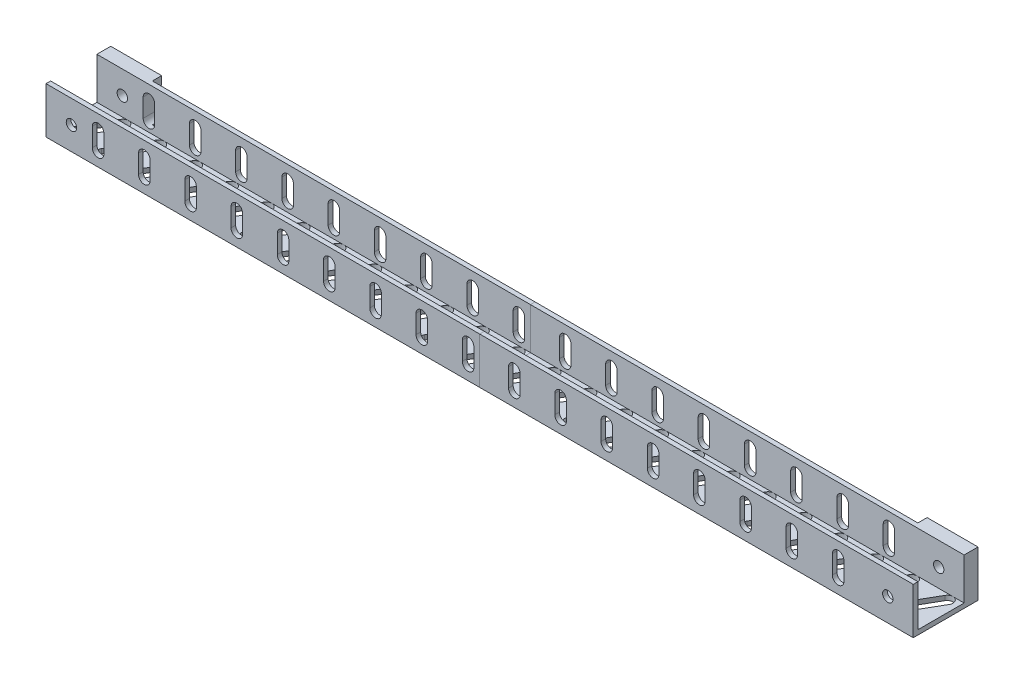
SolidWorks part; units mm, degrees
ref_plane "Front Plane" through (0, 0, 0) normal (0, 0, 1) x (1, 0, 0)
ref_plane "Top Plane" through (0, 0, 0) normal (0, 1, 0) x (1, 0, 0)
ref_plane "Right Plane" through (0, 0, 0) normal (1, 0, 0) x (0, 0, -1)
sketch "Sketch1" plane through (0, 0, 0) normal (1, 0, 0) x (0, 0, -1)
  line L0 (0, 0) -> (24, 0)
  line L1 (24, 0) -> (24, 20)
  line L2 (24, 20) -> (22, 20)
  line L3 (22, 20) -> (22, 2)
  line L4 (22, 2) -> (2, 2)
  line L5 (2, 2) -> (2, 20)
  line L6 (2, 20) -> (0, 20)
  line L7 (0, 20) -> (0, 0)
  dimension "D1" = 2
  dimension "D2" = 2
  dimension "D3" = 20
  dimension "D4" = 2
  dimension "D5" = 20
extrude "Boss-Extrude1" add sketch "Sketch1" along normal blind 375
sketch "Sketch2" plane through (0, 0, -24) normal (0, 0, -1) x (-1, 0, 0)
  line L0 (0, 0) -> (0, 20) construction
  line L1 (0, 0) -> (-22, 0)
  line L2 (0, 0) -> (0, 20)
  line L3 (0, 20) -> (-22, 20)
  line L4 (-22, 0) -> (-22, 20)
  line L5 (0, 10) -> (-375, 10) construction
  line L6 (-375, 0) -> (-375, 20) construction
  line L7 (-375, 20) -> (0, 20) construction
  line L8 (-187.5, 20) -> (-187.5, 0) construction
  line L9 (-375, 0) -> (0, 0) construction
  line L10 (-375, 20) -> (-353, 20)
  line L11 (-353, 0) -> (-353, 20)
  line L12 (-375, 0) -> (-353, 0)
  line L13 (-375, 0) -> (-375, 20)
  dimension "D1" = 22
extrude "Boss-Extrude2" add sketch "Sketch2" along normal blind 4
sketch "Sketch3" plane through (0, 0, -28) normal (0, 0, -1) x (-1, 0, 0)
  line L0 (0, 10) -> (-22, 10) construction
  line L1 (0, 0) -> (0, 20) construction
  line L2 (-22, 20) -> (-22, 0) construction
  line L3 (-187.5, 20) -> (-187.5, 0) construction
  line L4 (-353, 20) -> (-22, 20) construction
  line L5 (-353, 0) -> (-22, 0) construction
  circle A0 centre (-11, 10) radius 2.25
  circle A1 centre (-364, 10) radius 2.25
  dimension "D1" = 4.5
extrude "Cut-Extrude1" cut sketch "Sketch3" against normal through all
sketch "Sketch4" plane through (0, 2, 0) normal (0, 1, 0) x (1, 0, 0)
  line L0 (5, 4.5) -> (13.6603, 19.5) construction
  line L1 (2.8349, 5.75) -> (11.4952, 20.75)
  line L2 (7.1651, 3.25) -> (15.8253, 18.25)
  line L3 (375, 22) -> (0, 22) construction
  line L4 (375, 2) -> (0, 2) construction
  line L5 (375, 2) -> (0, 2) construction
  line L7 (0, 22) -> (0, 2) construction
  line L8 (22.6651, 3.25) -> (31.3253, 18.25)
  line L9 (18.3349, 5.75) -> (26.9952, 20.75)
  line L10 (20.5, 4.5) -> (29.1603, 19.5) construction
  line L11 (38.1651, 3.25) -> (46.8253, 18.25)
  line L12 (33.8349, 5.75) -> (42.4952, 20.75)
  line L13 (36, 4.5) -> (44.6603, 19.5) construction
  line L14 (53.6651, 3.25) -> (62.3253, 18.25)
  line L15 (49.3349, 5.75) -> (57.9952, 20.75)
  line L16 (51.5, 4.5) -> (60.1603, 19.5) construction
  line L17 (69.1651, 3.25) -> (77.8253, 18.25)
  line L18 (64.8349, 5.75) -> (73.4952, 20.75)
  line L19 (67, 4.5) -> (75.6603, 19.5) construction
  line L20 (84.6651, 3.25) -> (93.3253, 18.25)
  line L21 (80.3349, 5.75) -> (88.9952, 20.75)
  line L22 (82.5, 4.5) -> (91.1603, 19.5) construction
  line L23 (100.1651, 3.25) -> (108.8253, 18.25)
  line L24 (95.8349, 5.75) -> (104.4952, 20.75)
  line L25 (98, 4.5) -> (106.6603, 19.5) construction
  line L26 (115.6651, 3.25) -> (124.3253, 18.25)
  line L27 (111.3349, 5.75) -> (119.9952, 20.75)
  line L28 (113.5, 4.5) -> (122.1603, 19.5) construction
  line L29 (131.1651, 3.25) -> (139.8253, 18.25)
  line L30 (126.8349, 5.75) -> (135.4952, 20.75)
  line L31 (129, 4.5) -> (137.6603, 19.5) construction
  line L32 (146.6651, 3.25) -> (155.3253, 18.25)
  line L33 (142.3349, 5.75) -> (150.9952, 20.75)
  line L34 (144.5, 4.5) -> (153.1603, 19.5) construction
  line L35 (162.1651, 3.25) -> (170.8253, 18.25)
  line L36 (157.8349, 5.75) -> (166.4952, 20.75)
  line L37 (160, 4.5) -> (168.6603, 19.5) construction
  line L38 (177.6651, 3.25) -> (186.3253, 18.25)
  line L39 (173.3349, 5.75) -> (181.9952, 20.75)
  line L40 (175.5, 4.5) -> (184.1603, 19.5) construction
  line L41 (193.1651, 3.25) -> (201.8253, 18.25)
  line L42 (188.8349, 5.75) -> (197.4952, 20.75)
  line L43 (191, 4.5) -> (199.6603, 19.5) construction
  line L44 (208.6651, 3.25) -> (217.3253, 18.25)
  line L45 (204.3349, 5.75) -> (212.9952, 20.75)
  line L46 (206.5, 4.5) -> (215.1603, 19.5) construction
  line L47 (224.1651, 3.25) -> (232.8253, 18.25)
  line L48 (219.8349, 5.75) -> (228.4952, 20.75)
  line L49 (222, 4.5) -> (230.6603, 19.5) construction
  line L50 (239.6651, 3.25) -> (248.3253, 18.25)
  line L51 (235.3349, 5.75) -> (243.9952, 20.75)
  line L52 (237.5, 4.5) -> (246.1603, 19.5) construction
  line L53 (255.1651, 3.25) -> (263.8253, 18.25)
  line L54 (250.8349, 5.75) -> (259.4952, 20.75)
  line L55 (253, 4.5) -> (261.6603, 19.5) construction
  line L56 (270.6651, 3.25) -> (279.3253, 18.25)
  line L57 (266.3349, 5.75) -> (274.9952, 20.75)
  line L58 (268.5, 4.5) -> (277.1603, 19.5) construction
  line L59 (286.1651, 3.25) -> (294.8253, 18.25)
  line L60 (281.8349, 5.75) -> (290.4952, 20.75)
  line L61 (284, 4.5) -> (292.6603, 19.5) construction
  line L62 (301.6651, 3.25) -> (310.3253, 18.25)
  line L63 (297.3349, 5.75) -> (305.9952, 20.75)
  line L64 (299.5, 4.5) -> (308.1603, 19.5) construction
  line L65 (317.1651, 3.25) -> (325.8253, 18.25)
  line L66 (312.8349, 5.75) -> (321.4952, 20.75)
  line L67 (315, 4.5) -> (323.6603, 19.5) construction
  line L68 (332.6651, 3.25) -> (341.3253, 18.25)
  line L69 (328.3349, 5.75) -> (336.9952, 20.75)
  line L70 (330.5, 4.5) -> (339.1603, 19.5) construction
  line L71 (348.1651, 3.25) -> (356.8253, 18.25)
  line L72 (343.8349, 5.75) -> (352.4952, 20.75)
  line L73 (346, 4.5) -> (354.6603, 19.5) construction
  line L74 (363.6651, 3.25) -> (372.3253, 18.25)
  line L75 (359.3349, 5.75) -> (367.9952, 20.75)
  line L76 (361.5, 4.5) -> (370.1603, 19.5) construction
  line L79 (365, 4.5) -> (373.6603, 19.5) construction
  line L80 (7.1651, 3.25) -> (22.6651, 3.25) construction
  arc A0 (2.8349, 5.75) -> (7.1651, 3.25) centre (5, 4.5) ccw
  arc A1 (15.8253, 18.25) -> (11.4952, 20.75) centre (13.6603, 19.5) ccw
  arc A2 (18.3349, 5.75) -> (22.6651, 3.25) centre (20.5, 4.5) ccw
  arc A3 (31.3253, 18.25) -> (26.9952, 20.75) centre (29.1603, 19.5) ccw
  arc A4 (33.8349, 5.75) -> (38.1651, 3.25) centre (36, 4.5) ccw
  arc A5 (46.8253, 18.25) -> (42.4952, 20.75) centre (44.6603, 19.5) ccw
  arc A6 (49.3349, 5.75) -> (53.6651, 3.25) centre (51.5, 4.5) ccw
  arc A7 (62.3253, 18.25) -> (57.9952, 20.75) centre (60.1603, 19.5) ccw
  arc A8 (64.8349, 5.75) -> (69.1651, 3.25) centre (67, 4.5) ccw
  arc A9 (77.8253, 18.25) -> (73.4952, 20.75) centre (75.6603, 19.5) ccw
  arc A10 (80.3349, 5.75) -> (84.6651, 3.25) centre (82.5, 4.5) ccw
  arc A11 (93.3253, 18.25) -> (88.9952, 20.75) centre (91.1603, 19.5) ccw
  arc A12 (95.8349, 5.75) -> (100.1651, 3.25) centre (98, 4.5) ccw
  arc A13 (108.8253, 18.25) -> (104.4952, 20.75) centre (106.6603, 19.5) ccw
  arc A14 (111.3349, 5.75) -> (115.6651, 3.25) centre (113.5, 4.5) ccw
  arc A15 (124.3253, 18.25) -> (119.9952, 20.75) centre (122.1603, 19.5) ccw
  arc A16 (126.8349, 5.75) -> (131.1651, 3.25) centre (129, 4.5) ccw
  arc A17 (139.8253, 18.25) -> (135.4952, 20.75) centre (137.6603, 19.5) ccw
  arc A18 (142.3349, 5.75) -> (146.6651, 3.25) centre (144.5, 4.5) ccw
  arc A19 (155.3253, 18.25) -> (150.9952, 20.75) centre (153.1603, 19.5) ccw
  arc A20 (157.8349, 5.75) -> (162.1651, 3.25) centre (160, 4.5) ccw
  arc A21 (170.8253, 18.25) -> (166.4952, 20.75) centre (168.6603, 19.5) ccw
  arc A22 (173.3349, 5.75) -> (177.6651, 3.25) centre (175.5, 4.5) ccw
  arc A23 (186.3253, 18.25) -> (181.9952, 20.75) centre (184.1603, 19.5) ccw
  arc A24 (188.8349, 5.75) -> (193.1651, 3.25) centre (191, 4.5) ccw
  arc A25 (201.8253, 18.25) -> (197.4952, 20.75) centre (199.6603, 19.5) ccw
  arc A26 (204.3349, 5.75) -> (208.6651, 3.25) centre (206.5, 4.5) ccw
  arc A27 (217.3253, 18.25) -> (212.9952, 20.75) centre (215.1603, 19.5) ccw
  arc A28 (219.8349, 5.75) -> (224.1651, 3.25) centre (222, 4.5) ccw
  arc A29 (232.8253, 18.25) -> (228.4952, 20.75) centre (230.6603, 19.5) ccw
  arc A30 (235.3349, 5.75) -> (239.6651, 3.25) centre (237.5, 4.5) ccw
  arc A31 (248.3253, 18.25) -> (243.9952, 20.75) centre (246.1603, 19.5) ccw
  arc A32 (250.8349, 5.75) -> (255.1651, 3.25) centre (253, 4.5) ccw
  arc A33 (263.8253, 18.25) -> (259.4952, 20.75) centre (261.6603, 19.5) ccw
  arc A34 (266.3349, 5.75) -> (270.6651, 3.25) centre (268.5, 4.5) ccw
  arc A35 (279.3253, 18.25) -> (274.9952, 20.75) centre (277.1603, 19.5) ccw
  arc A36 (281.8349, 5.75) -> (286.1651, 3.25) centre (284, 4.5) ccw
  arc A37 (294.8253, 18.25) -> (290.4952, 20.75) centre (292.6603, 19.5) ccw
  arc A38 (297.3349, 5.75) -> (301.6651, 3.25) centre (299.5, 4.5) ccw
  arc A39 (310.3253, 18.25) -> (305.9952, 20.75) centre (308.1603, 19.5) ccw
  arc A40 (312.8349, 5.75) -> (317.1651, 3.25) centre (315, 4.5) ccw
  arc A41 (325.8253, 18.25) -> (321.4952, 20.75) centre (323.6603, 19.5) ccw
  arc A42 (328.3349, 5.75) -> (332.6651, 3.25) centre (330.5, 4.5) ccw
  arc A43 (341.3253, 18.25) -> (336.9952, 20.75) centre (339.1603, 19.5) ccw
  arc A44 (343.8349, 5.75) -> (348.1651, 3.25) centre (346, 4.5) ccw
  arc A45 (356.8253, 18.25) -> (352.4952, 20.75) centre (354.6603, 19.5) ccw
  arc A46 (359.3349, 5.75) -> (363.6651, 3.25) centre (361.5, 4.5) ccw
  arc A47 (372.3253, 18.25) -> (367.9952, 20.75) centre (370.1603, 19.5) ccw
  point P2 (9.3301, 12)
  point P14 (24.8301, 12)
  point P26 (40.3301, 12)
  point P33 (55.8301, 12)
  point P40 (71.3301, 12)
  point P47 (86.8301, 12)
  point P54 (102.3301, 12)
  point P61 (117.8301, 12)
  point P68 (133.3301, 12)
  point P75 (148.8301, 12)
  point P82 (164.3301, 12)
  point P89 (179.8301, 12)
  point P96 (195.3301, 12)
  point P103 (210.8301, 12)
  point P110 (226.3301, 12)
  point P117 (241.8301, 12)
  point P124 (257.3301, 12)
  point P131 (272.8301, 12)
  point P138 (288.3301, 12)
  point P145 (303.8301, 12)
  point P152 (319.3301, 12)
  point P159 (334.8301, 12)
  point P166 (350.3301, 12)
  point P173 (365.8301, 12)
  point P180 (369.3301, 12)
  dimension "D1" = 5
  dimension "D2" = 60
  dimension "D3" = 5
  dimension "D5" = 15.5
  dimension "D4" = 24
extrude "Cut-Extrude2" cut sketch "Sketch4" against normal through all
sketch "Sketch5" plane through (0, 0, 0) normal (0, 0, 1) x (1, 0, 0)
  line L0 (22.5, 14) -> (22.5, 6) construction
  line L1 (25, 14) -> (25, 6)
  line L2 (20, 14) -> (20, 6)
  line L3 (0, 10) -> (375, 10) construction
  line L4 (0, 20) -> (0, 0) construction
  line L5 (375, 20) -> (375, 0) construction
  line L6 (40, 14) -> (40, 6)
  line L7 (45, 14) -> (45, 6)
  line L8 (42.5, 14) -> (42.5, 6) construction
  line L9 (60, 14) -> (60, 6)
  line L10 (65, 14) -> (65, 6)
  line L11 (62.5, 14) -> (62.5, 6) construction
  line L12 (80, 14) -> (80, 6)
  line L13 (85, 14) -> (85, 6)
  line L14 (82.5, 14) -> (82.5, 6) construction
  line L15 (100, 14) -> (100, 6)
  line L16 (105, 14) -> (105, 6)
  line L17 (102.5, 14) -> (102.5, 6) construction
  line L18 (120, 14) -> (120, 6)
  line L19 (125, 14) -> (125, 6)
  line L20 (122.5, 14) -> (122.5, 6) construction
  line L21 (140, 14) -> (140, 6)
  line L22 (145, 14) -> (145, 6)
  line L23 (142.5, 14) -> (142.5, 6) construction
  line L24 (160, 14) -> (160, 6)
  line L25 (165, 14) -> (165, 6)
  line L26 (162.5, 14) -> (162.5, 6) construction
  line L27 (180, 14) -> (180, 6)
  line L28 (185, 14) -> (185, 6)
  line L29 (182.5, 14) -> (182.5, 6) construction
  line L30 (200, 14) -> (200, 6)
  line L31 (205, 14) -> (205, 6)
  line L32 (202.5, 14) -> (202.5, 6) construction
  line L33 (220, 14) -> (220, 6)
  line L34 (225, 14) -> (225, 6)
  line L35 (222.5, 14) -> (222.5, 6) construction
  line L36 (240, 14) -> (240, 6)
  line L37 (245, 14) -> (245, 6)
  line L38 (242.5, 14) -> (242.5, 6) construction
  line L39 (260, 14) -> (260, 6)
  line L40 (265, 14) -> (265, 6)
  line L41 (262.5, 14) -> (262.5, 6) construction
  line L42 (280, 14) -> (280, 6)
  line L43 (285, 14) -> (285, 6)
  line L44 (282.5, 14) -> (282.5, 6) construction
  line L45 (300, 14) -> (300, 6)
  line L46 (305, 14) -> (305, 6)
  line L47 (302.5, 14) -> (302.5, 6) construction
  line L48 (320, 14) -> (320, 6)
  line L49 (325, 14) -> (325, 6)
  line L50 (322.5, 14) -> (322.5, 6) construction
  line L51 (340, 14) -> (340, 6)
  line L52 (345, 14) -> (345, 6)
  line L53 (342.5, 14) -> (342.5, 6) construction
  line L54 (20, 14) -> (40, 14) construction
  arc A0 (25, 14) -> (20, 14) centre (22.5, 14) ccw
  arc A1 (20, 6) -> (25, 6) centre (22.5, 6) ccw
  arc A2 (45, 14) -> (40, 14) centre (42.5, 14) ccw
  arc A3 (40, 6) -> (45, 6) centre (42.5, 6) ccw
  arc A4 (65, 14) -> (60, 14) centre (62.5, 14) ccw
  arc A5 (60, 6) -> (65, 6) centre (62.5, 6) ccw
  arc A6 (85, 14) -> (80, 14) centre (82.5, 14) ccw
  arc A7 (80, 6) -> (85, 6) centre (82.5, 6) ccw
  arc A8 (105, 14) -> (100, 14) centre (102.5, 14) ccw
  arc A9 (100, 6) -> (105, 6) centre (102.5, 6) ccw
  arc A10 (125, 14) -> (120, 14) centre (122.5, 14) ccw
  arc A11 (120, 6) -> (125, 6) centre (122.5, 6) ccw
  arc A12 (145, 14) -> (140, 14) centre (142.5, 14) ccw
  arc A13 (140, 6) -> (145, 6) centre (142.5, 6) ccw
  arc A14 (165, 14) -> (160, 14) centre (162.5, 14) ccw
  arc A15 (160, 6) -> (165, 6) centre (162.5, 6) ccw
  arc A16 (185, 14) -> (180, 14) centre (182.5, 14) ccw
  arc A17 (180, 6) -> (185, 6) centre (182.5, 6) ccw
  arc A18 (205, 14) -> (200, 14) centre (202.5, 14) ccw
  arc A19 (200, 6) -> (205, 6) centre (202.5, 6) ccw
  arc A20 (225, 14) -> (220, 14) centre (222.5, 14) ccw
  arc A21 (220, 6) -> (225, 6) centre (222.5, 6) ccw
  arc A22 (245, 14) -> (240, 14) centre (242.5, 14) ccw
  arc A23 (240, 6) -> (245, 6) centre (242.5, 6) ccw
  arc A24 (265, 14) -> (260, 14) centre (262.5, 14) ccw
  arc A25 (260, 6) -> (265, 6) centre (262.5, 6) ccw
  arc A26 (285, 14) -> (280, 14) centre (282.5, 14) ccw
  arc A27 (280, 6) -> (285, 6) centre (282.5, 6) ccw
  arc A28 (305, 14) -> (300, 14) centre (302.5, 14) ccw
  arc A29 (300, 6) -> (305, 6) centre (302.5, 6) ccw
  arc A30 (325, 14) -> (320, 14) centre (322.5, 14) ccw
  arc A31 (320, 6) -> (325, 6) centre (322.5, 6) ccw
  arc A32 (345, 14) -> (340, 14) centre (342.5, 14) ccw
  arc A33 (340, 6) -> (345, 6) centre (342.5, 6) ccw
  point P2 (22.5, 10)
  point P17 (42.5, 10)
  point P24 (62.5, 10)
  point P31 (82.5, 10)
  point P38 (102.5, 10)
  point P45 (122.5, 10)
  point P52 (142.5, 10)
  point P59 (162.5, 10)
  point P66 (182.5, 10)
  point P73 (202.5, 10)
  point P80 (222.5, 10)
  point P87 (242.5, 10)
  point P94 (262.5, 10)
  point P101 (282.5, 10)
  point P108 (302.5, 10)
  point P115 (322.5, 10)
  point P122 (342.5, 10)
  dimension "D2" = 8
  dimension "D1" = 5
  dimension "D3" = 20
  dimension "D5" = 20
  dimension "D4" = 17
extrude "Cut-Extrude3" cut sketch "Sketch5" against normal through all
ref_plane "Plane1" through (187.5, 0, 0) normal (-1, 0, 0) x (0, 0, 1)
sketch "Sketch6" plane through (187.5, 0, 0) normal (-1, 0, 0) x (0, 0, 1)
  line L1 (-31.0819, 21.894) -> (4.8989, 21.894)
  line L2 (-31.0819, 21.894) -> (-31.0819, -3.1133)
  line L3 (-31.0819, -3.1133) -> (4.8989, -3.1133)
  line L4 (4.8989, 21.894) -> (4.8989, -3.1133)
extrude "Cut-Extrude4" [suppressed] cut sketch "Sketch6" along normal up to surface (187.5 mm away)
sketch "Sketch7" [suppressed] plane through (187.5, 0, 0) normal (-1, 0, 0) x (0, 0, 1)
  line L0 (-22, 2) -> (-24, 0) construction
  line L1 (-3.4378, 1) -> (-24, 1) construction
  line L2 (-3.4378, 0) -> (-3.4378, 2) construction
  line L3 (-24, 0) -> (-24, 20) construction
  line L4 (-22, 20) -> (-2, 20) construction
  line L5 (-12, 20) -> (-12, 0) construction
  line L6 (-24, 0) -> (0, 0) construction
  line L7 (-22, 2) -> (-22, 20) construction
  circle A0 centre (-23, 1) radius 0.6
  circle A1 centre (-1, 1) radius 0.6
  dimension "D1" = 1.2
extrude "Cut-Extrude5" [suppressed] cut sketch "Sketch7" against normal blind 10
split "Split1" trim tools "Plane1" bodies to split 112 resulting bodies 115 116
